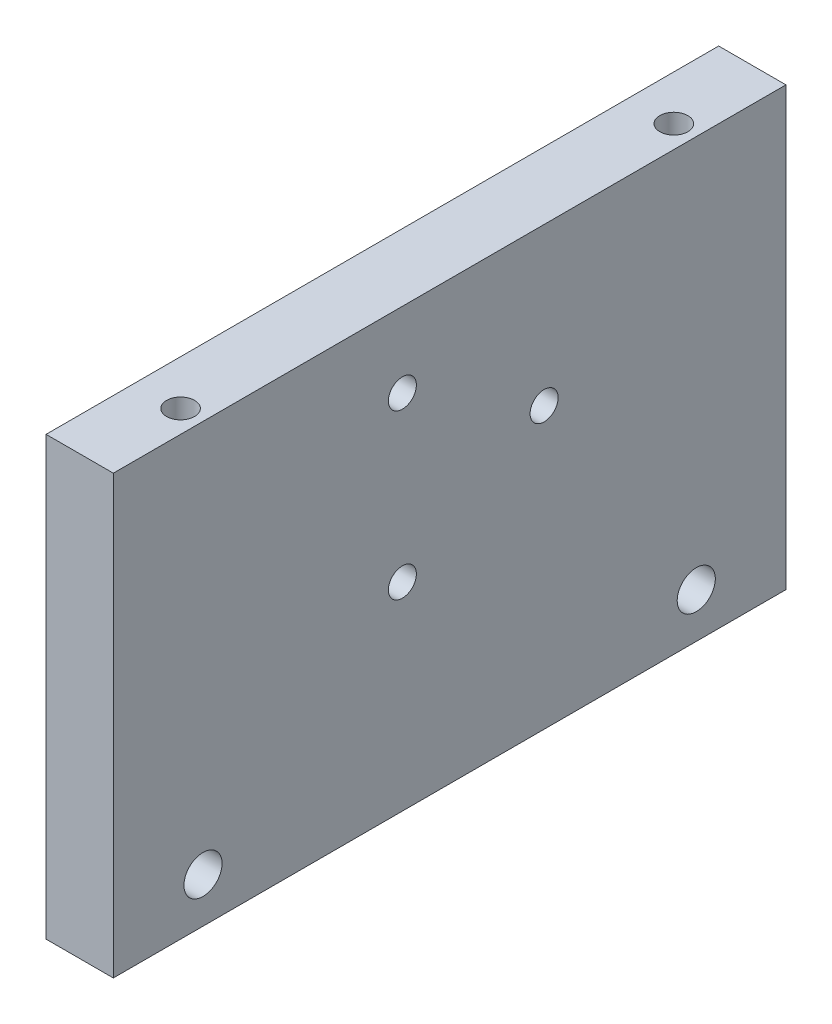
SolidWorks part; units mm, degrees
ref_plane "Front Plane" through (0, 0, 0) normal (0, 0, 1) x (1, 0, 0)
ref_plane "Top Plane" through (0, 0, 0) normal (0, 1, 0) x (1, 0, 0)
ref_plane "Right Plane" through (0, 0, 0) normal (1, 0, 0) x (0, 0, -1)
sketch "Sketch1" plane through (0, 0, 0) normal (1, 0, 0) x (0, 0, -1)
  line L1 (-30, -19.5) -> (30, -19.5)
  line L2 (-30, -19.5) -> (-30, 19.5)
  line L3 (-30, 19.5) -> (30, 19.5)
  line L4 (30, -19.5) -> (30, 19.5)
  line L5 (-30, -19.5) -> (30, 19.5) construction
  line L6 (-30, 19.5) -> (30, -19.5) construction
  point P0 (0, 0)
  dimension "D1" = 39
  dimension "D2" = 60
extrude "Boss-Extrude1" add sketch "Sketch1" along normal mid plane 6
hole_wizard "CSK for M3 Flat Head Machine Screw1" positions "Sketch3" profile "Sketch2" countersink size "M3" standard "ANSI Metric"
sketch "Sketch3" plane through (-3, 0, 0) normal (-1, 0, 0) x (0, 0, 1)
  point P0 (-22, -15.5)
  point P3 (22, -15.5)
sketch "Sketch2" plane through (-3, -15.5, -22) normal (0, 1, 0) x (0, 0, 1)
  line L0 (0, 0) -> (0, 6)
  line L1 (0, 6) -> (1.7, 6)
  line L2 (1.7, 6) -> (1.7, 1.45)
  line L3 (1.7, 1.45) -> (3.15, 0)
  line L5 (3.15, 0) -> (0, 0)
  line L6 (-1.7, 1.45) -> (-3.15, 0) construction
  line L11 (0, -6.35) -> (0, 107.95) construction
  dimension "Thru Hole Dia." = 3.4
  dimension "Thru Hole Depth" = 6
  dimension "Near C'Sink Dia." = 6.3
  dimension "Near C'Sink Angle" = 90
hole_wizard "M3x0.5 Tapped Hole1" positions "Sketch5" profile "Sketch4" tap size "M3x0.5" standard "ANSI Metric"
sketch "Sketch5" plane through (0, 19.5, 0) normal (0, 1, 0) x (1, 0, 0)
  line L0 (1, 30) -> (1, 22) construction
  line L1 (3, 30) -> (-3, 30) construction
  line L2 (1, 22) -> (1, -22) construction
  line L3 (1, -22) -> (1, -30) construction
  line L4 (3, -30) -> (-3, -30) construction
  line L6 (-3, 30) -> (-3, -30) construction
  point P0 (1, 22)
  point P2 (1, -22)
  dimension "D1" = 8
  dimension "D2" = 4
sketch "Sketch4" plane through (1, 19.5, -22) normal (1, 0, 0) x (0, 0, 1)
  line L0 (0, 0) -> (0, 8.2511)
  line L1 (0, 8.2511) -> (1.25, 7.5)
  line L2 (1.25, 7.5) -> (1.25, 0)
  line L5 (1.25, 0) -> (0, 0)
  line L10 (0, 8.2511) -> (-1.25, 7.5) construction
  line L11 (0, -6.35) -> (0, 107.95) construction
  dimension "Tap Drill Dia." = 2.5
  dimension "Tap Drill Depth" = 7.5
  dimension "Drill Angle" = 118
hole_wizard "M3x0.5 Tapped Hole2" positions "Sketch7" profile "Sketch6" tap size "M3x0.5" standard "ANSI Metric"
sketch "Sketch7" plane through (-3, 0, 0) normal (-1, 0, 0) x (0, 0, 1)
  arc A0 (3.6662, 14.85) -> (6.2643, 13.35) centre (4.9652, 14.1) ccw construction
  arc A1 (6.2643, -2.35) -> (3.6662, -3.85) centre (4.9652, -3.1) ccw construction
  point P0 (-8.4293, 5.5)
  point P3 (4.2152, 12.801)
  point P8 (4.2152, -1.801)
sketch "Sketch6" plane through (-3, 5.5, -8.4293) normal (0, 1, 0) x (0, 0, 1)
  line L0 (0, 0) -> (0, 6)
  line L1 (0, 6) -> (1.25, 6)
  line L2 (1.25, 6) -> (1.25, 0)
  line L5 (1.25, 0) -> (0, 0)
  line L11 (0, -6.35) -> (0, 107.95) construction
  dimension "Thru Tap Drill Dia." = 2.5
  dimension "Thru Tap Drill Depth" = 6
